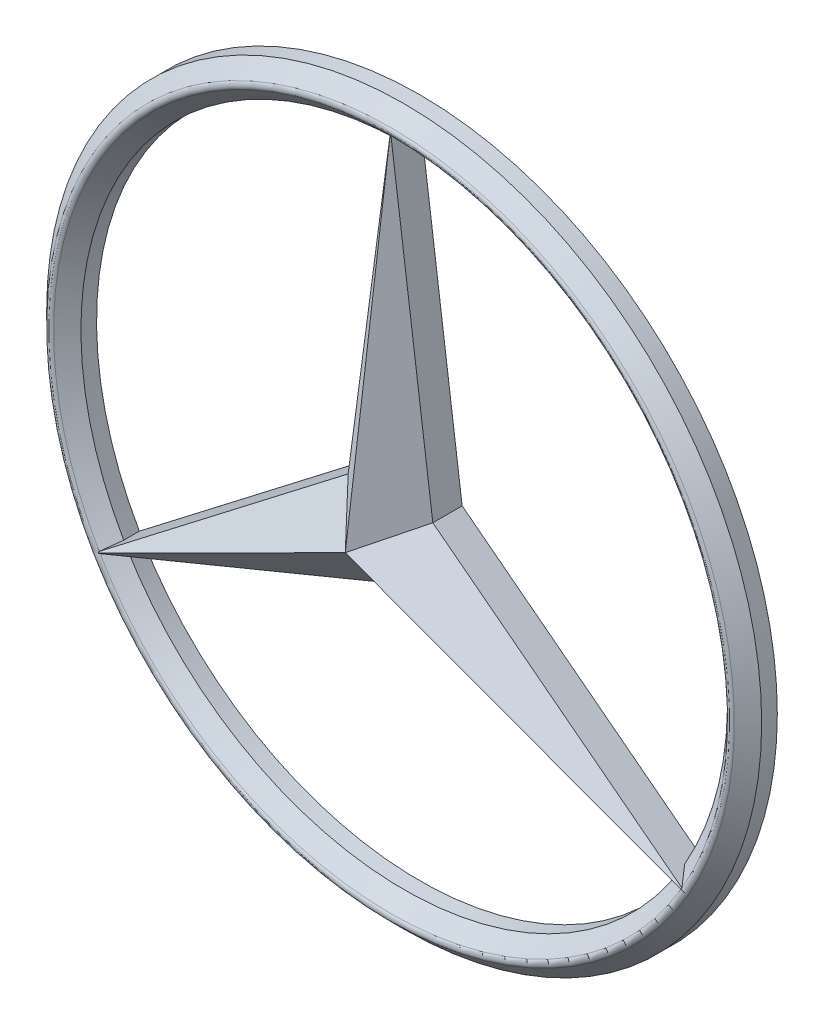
SolidWorks part; units mm, degrees
ref_plane "Front Plane" through (0, 0, 0) normal (0, 0, 1) x (1, 0, 0)
ref_plane "Top Plane" through (0, 0, 0) normal (0, 1, 0) x (1, 0, 0)
ref_plane "Right Plane" through (0, 0, 0) normal (1, 0, 0) x (0, 0, -1)
sketch "Sketch2" plane through (0, 0, 0) normal (0, 0, 1) x (1, 0, 0)
  line L0 (-30.3109, -12.5) -> (-4.3301, 7.5)
  line L1 (0, 0) -> (4.3301, 7.5) construction
  line L2 (4.3301, 7.5) -> (-4.3301, 7.5) construction
  line L3 (-4.3301, 7.5) -> (0, 0) construction
  line L4 (0, 40) -> (-30.3109, -12.5) construction
  line L5 (-30.3109, -12.5) -> (30.3109, -12.5) construction
  line L6 (30.3109, -12.5) -> (0, 40) construction
  line L7 (-4.3301, 7.5) -> (0, 40)
  line L8 (0, 40) -> (4.3301, 7.5)
  line L9 (4.3301, 7.5) -> (30.3109, -12.5)
  line L10 (30.3109, -12.5) -> (0, 0)
  line L11 (0, 0) -> (-30.3109, -12.5)
  circle A0 centre (0, 5) radius 2.5 construction
  circle A1 centre (0, 5) radius 17.5 construction
  dimension "D1" = 5
  dimension "D2" = 35
extrude "Boss-Extrude1" add sketch "Sketch2" along normal blind 3
sketch "Sketch3" plane through (0, 0, 3) normal (0, 0, 1) x (1, 0, 0)
  line L6 (-30.3109, -12.5) -> (0, 0)
  line L7 (0, 0) -> (30.3109, -12.5)
  line L8 (30.3109, -12.5) -> (4.3301, 7.5)
  line L9 (4.3301, 7.5) -> (0, 40)
  line L10 (0, 40) -> (-4.3301, 7.5)
  line L11 (-4.3301, 7.5) -> (-30.3109, -12.5)
  line L12 (-30.3109, -12.5) -> (0, 0)
  line L13 (0, 0) -> (30.3109, -12.5)
  line L14 (30.3109, -12.5) -> (4.3301, 7.5)
  line L15 (4.3301, 7.5) -> (0, 40)
  line L16 (0, 40) -> (-4.3301, 7.5)
  line L17 (-4.3301, 7.5) -> (-30.3109, -12.5)
  dimension "D1" = 0
extrude "Boss-Extrude2" add sketch "Sketch3" along normal blind 31 draft 45 separate body
sketch "Sketch6" plane through (0, 0, 0) normal (1, 0, 0) x (0, 0, -1)
  line L0 (-7.6224, 5) -> (0, 5) construction
  line L1 (0, -12.5) -> (0, 7.5) construction
  line L2 (-7.6224, 5) -> (-7.3198, 5)
  line L4 (-2.6974, 40) -> (-3, 40)
  line L6 (-3, 40) -> (0, 40) construction
revolve "Cut-Revolve3" cut sketch "Sketch6" angle 360 about L0
sketch "Sketch7" plane through (0, 0, 0) normal (1, 0, 0) x (0, 0, -1)
  line L0 (-7.2693, 5.1909) -> (0, 5.1909) construction
  line L1 (0, -12.5) -> (0, 7.5) construction
  line L2 (0, 38.25) -> (0, 41.75)
  line L3 (0, 40) -> (-3.35, 40) construction
  line L4 (0, 41.75) -> (-1.6, 41.75)
  line L5 (-1.6, 41.75) -> (-3.35, 40)
  line L6 (-3.35, 40) -> (-1.6, 38.25)
  line L7 (-1.6, 38.25) -> (0, 38.25)
  line L8 (-1.6, 38.25) -> (-1.6, 41.75) construction
  point P10 (0, 40)
  dimension "D1" = 1.6
  dimension "D2" = 3.5
  dimension "D3" = 90
revolve "Revolve1" add sketch "Sketch7" angle 360 about L0
fillet "Fillet2" radius 0.5 1 edges at (0, -29.6181, 3.35)
scale "Scale1" scale about centroid uniform scaling yes scale factor 0.8
